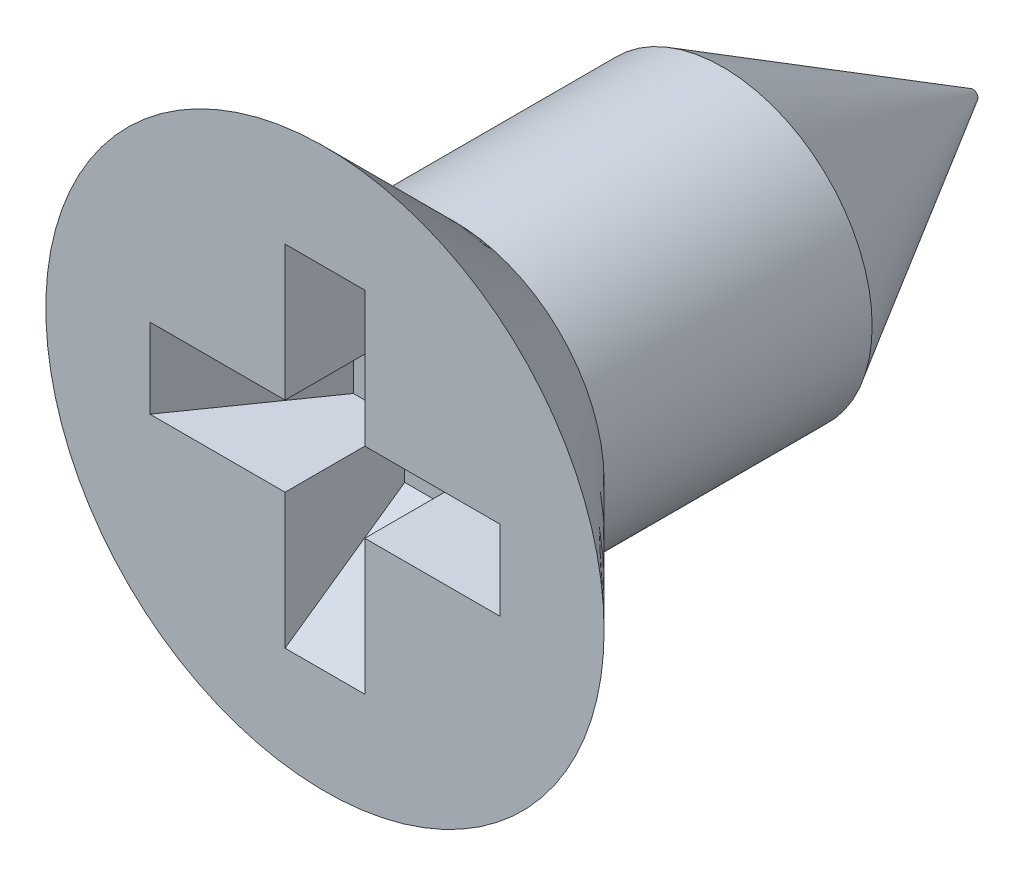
SolidWorks part; units mm, degrees
ref_plane "Plan de face" through (0, 0, 0) normal (0, 0, 1) x (1, 0, 0)
ref_plane "Plan de dessus" through (0, 0, 0) normal (0, 1, 0) x (1, 0, 0)
ref_plane "Plan de droite" through (0, 0, 0) normal (1, 0, 0) x (0, 0, -1)
sketch "Esquisse1" plane through (0, 0, 0) normal (1, 0, 0) x (0, 0, -1)
  line L0 (-1.6035, 0) -> (7.1529, 0) construction
  line L1 (0, 5.0438) -> (0, -4.594) construction
  line L2 (0, 2.8) -> (1.3, 1.5)
  line L3 (1.3, 1.5) -> (1.3, 0)
  line L4 (-1.442, 2.8) -> (2.7621, 2.8) construction
  line L5 (0, 2.8) -> (8.0274, -5.2274) construction
  line L6 (-1.0988, 1.5) -> (4.1029, 1.5) construction
  line L7 (1.3, 0) -> (0, 0)
  line L9 (0, 2.8) -> (0, 0)
revolve "Révolution2" add sketch "Esquisse1" angle 360 about L0
sketch "Esquisse3" plane through (0, 0, 0) normal (0, 0, 1) x (1, 0, 0)
  circle A0 centre (0, 0) radius 1.5
extrude "Extrusion1" add sketch "Esquisse3" against normal blind 6.5
sketch "Esquisse2" plane through (0, 0, 0) normal (0, 0, 1) x (1, 0, 0)
  line L0 (0.4, -0.4) -> (1.755, -0.4)
  line L1 (0.4, 0.4) -> (1.755, 0.4)
  line L2 (-1.755, -0.4) -> (-0.4, -0.4)
  line L3 (-0.4, 1.755) -> (-0.4, 0.4)
  line L4 (-1.755, 0.4) -> (-0.4, 0.4)
  line L5 (0.4, 1.755) -> (0.4, 0.4)
  line L6 (-0.4, 1.755) -> (0.4, 1.755)
  line L7 (1.755, 0.4) -> (1.755, -0.4)
  line L8 (0.4, -1.755) -> (-0.4, -1.755)
  line L9 (-1.755, -0.4) -> (-1.755, 0.4)
  line L10 (-0.4, -0.4) -> (-0.4, -1.755)
  line L12 (0.4, -0.4) -> (0.4, -1.755)
  circle A0 centre (0, 0) radius 1.8 construction
extrude "Enlèv. mat.-Extru.2" cut sketch "Esquisse2" against normal blind 1.2
draft "Dépouille3" type of draft neutral plane draft angle 35 faces to draft 4 parameters "D1"=35
chamfer "Chanfrein1" distance 1.45 angle 60 1 edges at (1.5, 0, -6.5)
